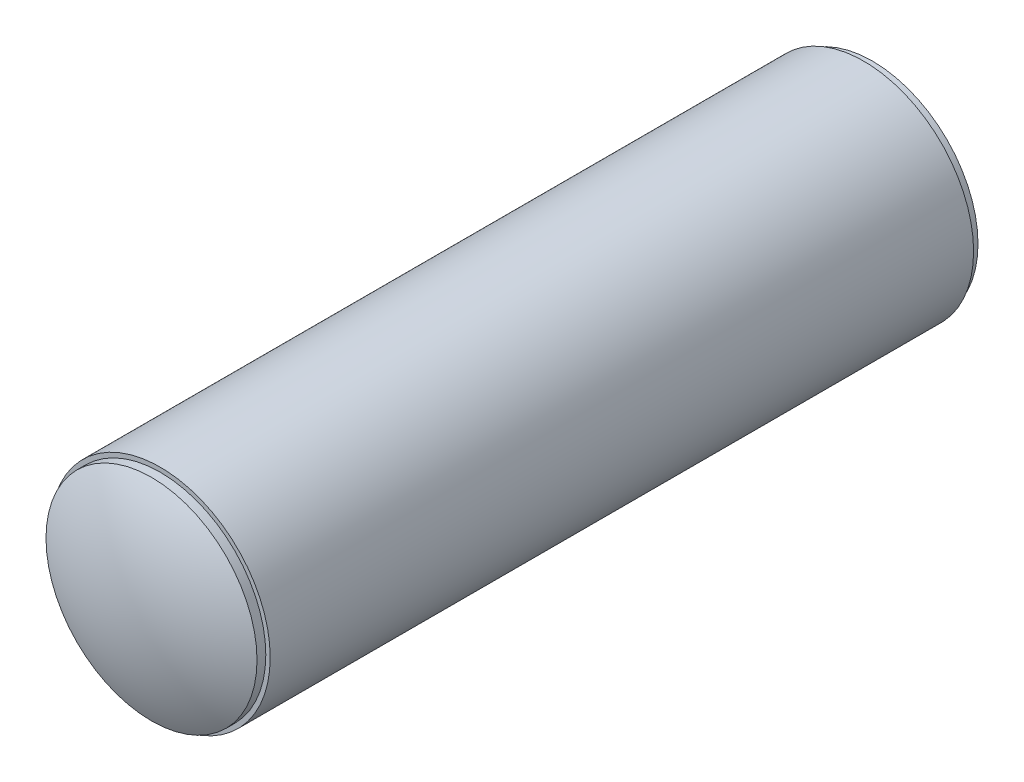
SolidWorks part; units mm, degrees
ref_plane "Front Plane" through (0, 0, 0) normal (0, 0, 1) x (1, 0, 0)
ref_plane "Top Plane" through (0, 0, 0) normal (0, 1, 0) x (1, 0, 0)
ref_plane "Right Plane" through (0, 0, 0) normal (1, 0, 0) x (0, 0, -1)
sketch "Sketch1" plane through (0, 0, 0) normal (0, 0, 1) x (1, 0, 0)
  circle A0 centre (0, 0) radius 1
  circle A1 centre (0, 0) radius 2.5
  dimension "D1" = 5
  dimension "D2" = 2
extrude "Boss-Extrude1" add sketch "Sketch1" along normal mid plane 16
sketch "Sketch2" plane through (0, 0, 0) normal (1, 0, 0) x (0, 0, -1)
  line L0 (0, 0) -> (-9.4833, 0) construction
  line L1 (-8.8, 0) -> (-5, 0)
  line L2 (-8, 2.5) -> (-8, -2.5) construction
  line L3 (-5, 0) -> (-5, -1)
  line L4 (-8, -1) -> (8, -1) construction
  line L5 (-5, -1) -> (-8, -1)
  line L6 (-8, -1) -> (-8, -2.4)
  line L7 (-8.2, -2.4) -> (-8, -2.4)
  line L8 (-8.8, 0) -> (-8.8, 0.7914) construction
  line L9 (0, 0) -> (0, -4.3811) construction
  line L10 (8.2, -2.4) -> (8, -2.4)
  line L11 (8, -1) -> (8, -2.4)
  line L12 (8.8, 0) -> (5, 0)
  line L13 (5, -1) -> (8, -1)
  line L14 (5, 0) -> (5, -1)
  arc A0 (-8.8, 0) -> (-8.2, -2.4) centre (-3.7, 0) ccw
  arc A1 (8.8, 0) -> (8.2, -2.4) centre (3.7, 0) cw
  dimension "D1" = 3
  dimension "D2" = 2.4
  dimension "D3" = 0.8
  dimension "D4" = 0.2
revolve "Revolve1" add sketch "Sketch2" angle 360 about L1
